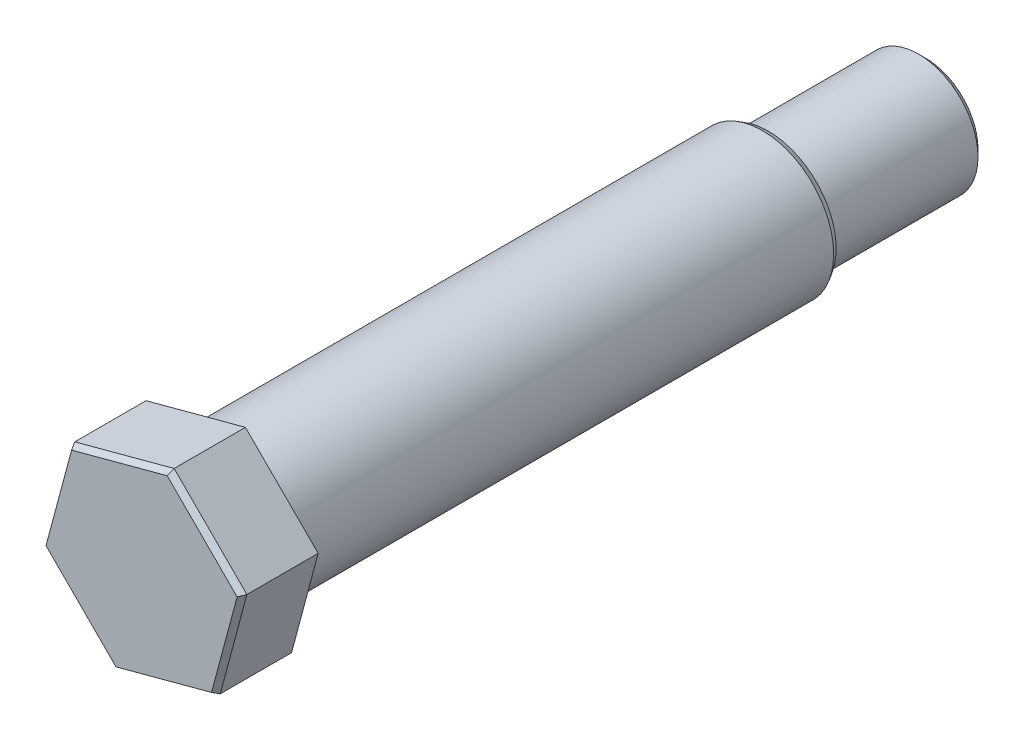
SolidWorks part; units mm, degrees
ref_plane "Plan1" through (0, 0, 0) normal (0, 0, 1) x (1, 0, 0)
ref_plane "Plan2" through (0, 0, 0) normal (0, 1, 0) x (1, 0, 0)
ref_plane "Plan3" through (0, 0, 0) normal (1, 0, 0) x (0, 0, -1)
sketch "Esquisse1" plane through (0, 0, 0) normal (0, 0, 1) x (1, 0, 0)
  line L0 (0, 70) -> (0, -60) construction
  line L1 (-100, 0) -> (110, 0) construction
  line L3 (12.2474, -12.2474) -> (16.7303, 4.4829)
  line L4 (16.7303, 4.4829) -> (4.4829, 16.7303)
  line L5 (4.4829, 16.7303) -> (-12.2474, 12.2474)
  line L6 (-12.2474, 12.2474) -> (-16.7303, -4.4829)
  line L7 (-16.7303, -4.4829) -> (-4.4829, -16.7303)
  line L8 (-4.4829, -16.7303) -> (12.2474, -12.2474)
  circle A0 centre (0, 0) radius 15 construction
  dimension "D1" = 30
extrude "Base-Extrusion" add sketch "Esquisse1" along normal blind 13
chamfer "Chanfrein1" distance 1 angle 30
sketch "Esquisse2" plane through (0, 0, 0) normal (0, 0, -1) x (-1, 0, 0)
  circle A0 centre (0, 0) radius 12
  dimension "D1" = 24
extrude "Boss.-Extru.1" add sketch "Esquisse2" along normal blind 92.5
sketch "Esquisse3" plane through (0, 0, -92.5) normal (0, 0, -1) x (-1, 0, 0)
  circle A0 centre (0, 0) radius 10
  dimension "D1" = 20
extrude "Boss.-Extru.2" add sketch "Esquisse3" along normal blind 26.5
chamfer "Chanfrein2" distance 1 angle 30
chamfer "Chanfrein3" distance 1.2 angle 45
fillet "Congé1" radius 0.5
